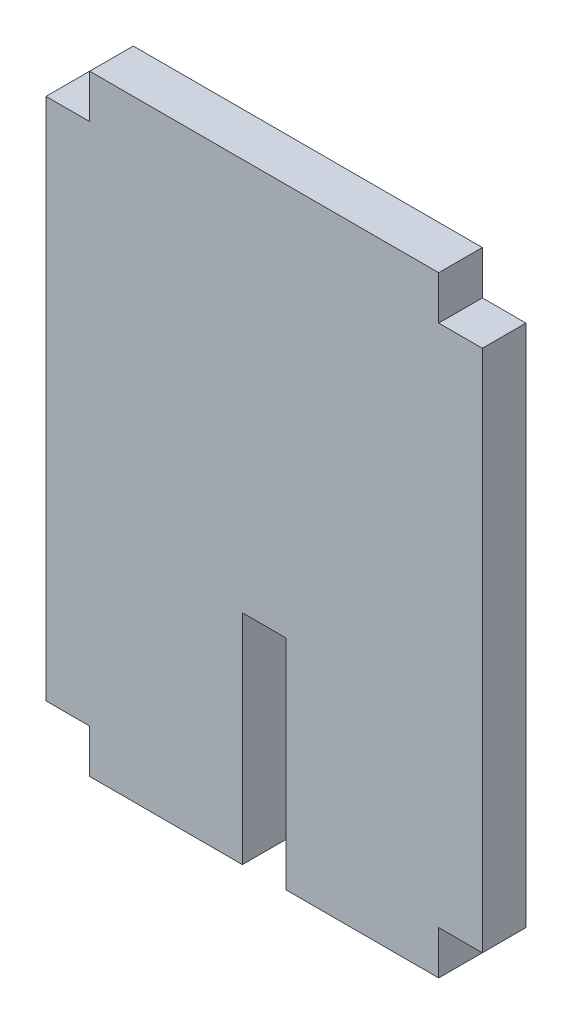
SolidWorks part; units mm, degrees
ref_plane "Front Plane" through (0, 0, 0) normal (0, 0, 1) x (1, 0, 0)
ref_plane "Top Plane" through (0, 0, 0) normal (0, 1, 0) x (1, 0, 0)
ref_plane "Right Plane" through (0, 0, 0) normal (1, 0, 0) x (0, 0, -1)
sketch "Sketch1" plane through (0, 0, 0) normal (0, 0, 1) x (1, 0, 0)
  line L1 (-15.875, 22.225) -> (15.875, 22.225)
  line L2 (-15.875, 22.225) -> (-15.875, -22.225)
  line L3 (-15.875, -22.225) -> (15.875, -22.225)
  line L4 (15.875, 22.225) -> (15.875, -22.225)
  line L5 (-15.875, 22.225) -> (15.875, -22.225) construction
  line L6 (-15.875, -22.225) -> (15.875, 22.225) construction
  point P1 (0, 0)
  dimension "D1" = 31.75
  dimension "D2" = 44.45
extrude "Boss-Extrude1" add sketch "Sketch1" along normal blind 3.175
sketch "Sketch2" plane through (0, 0, 3.175) normal (0, 0, 1) x (1, 0, 0)
  line L0 (0, 23.4877) -> (0, -23.5429) construction
  line L1 (-15.875, 22.225) -> (-12.7, 22.225)
  line L2 (-15.875, 22.225) -> (-15.875, 19.05)
  line L3 (-15.875, 19.05) -> (-12.7, 19.05)
  line L4 (-12.7, 22.225) -> (-12.7, 19.05)
  line L5 (-22.6045, 0) -> (19.7341, 0) construction
  line L6 (12.7, 22.225) -> (12.7, 19.05)
  line L7 (15.875, 19.05) -> (12.7, 19.05)
  line L8 (15.875, 22.225) -> (15.875, 19.05)
  line L9 (15.875, 22.225) -> (12.7, 22.225)
  line L10 (15.875, -22.225) -> (12.7, -22.225)
  line L11 (15.875, -22.225) -> (15.875, -19.05)
  line L12 (15.875, -19.05) -> (12.7, -19.05)
  line L13 (12.7, -22.225) -> (12.7, -19.05)
  line L14 (-12.7, -22.225) -> (-12.7, -19.05)
  line L15 (-15.875, -19.05) -> (-12.7, -19.05)
  line L16 (-15.875, -22.225) -> (-15.875, -19.05)
  line L17 (-15.875, -22.225) -> (-12.7, -22.225)
  dimension "D1" = 3.175
  dimension "D2" = 3.175
extrude "Cut-Extrude1" cut sketch "Sketch2" against normal through all
sketch "Sketch3" plane through (0, 0, 3.175) normal (0, 0, 1) x (1, 0, 0)
  line L0 (-12.7, -22.225) -> (12.7, -22.225) construction
  line L1 (-1.5875, -22.225) -> (1.5875, -22.225)
  line L2 (-1.5875, -22.225) -> (-1.5875, -6.35)
  line L3 (-1.5875, -6.35) -> (1.5875, -6.35)
  line L4 (1.5875, -22.225) -> (1.5875, -6.35)
  dimension "D1" = 15.875
  dimension "D2" = 3.175
  dimension "D3" = 1.5875
extrude "Cut-Extrude2" cut sketch "Sketch3" against normal through all
